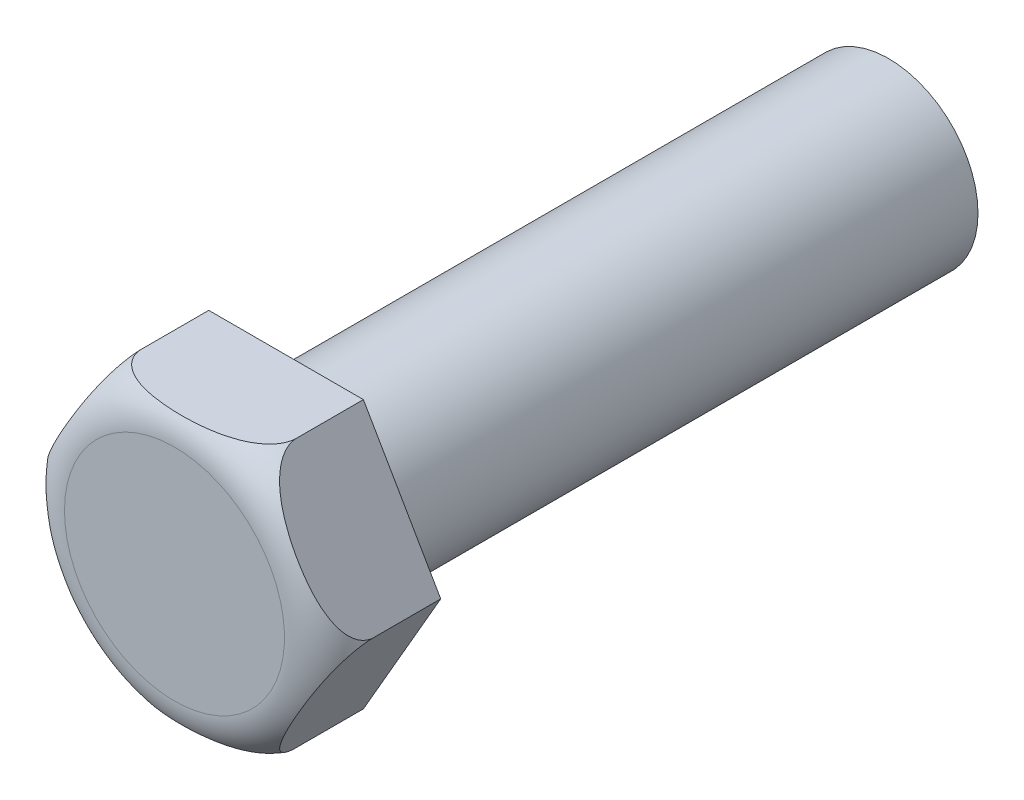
SolidWorks part; units mm, degrees
ref_plane "Front" through (0, 0, 0) normal (0, 0, 1) x (1, 0, 0)
ref_plane "Top" through (0, 0, 0) normal (0, 1, 0) x (1, 0, 0)
ref_plane "Right" through (0, 0, 0) normal (1, 0, 0) x (0, 0, -1)
sketch "Sketch1" plane through (0, 0, 0) normal (0, 0, 1) x (1, 0, 0)
  circle A1 centre (35, 0) radius 4
extrude "Extrude1" add sketch "Sketch1" against normal blind 27
sketch "Sketch2" plane through (0, 0, 0) normal (0, 0, 1) x (1, 0, 0)
  line L1 (41.9282, 0) -> (38.4641, 6)
  line L2 (38.4641, 6) -> (31.5359, 6)
  line L3 (31.5359, 6) -> (28.0718, 0)
  line L4 (28.0718, 0) -> (31.5359, -6)
  line L5 (31.5359, -6) -> (38.4641, -6)
  line L6 (38.4641, -6) -> (41.9282, 0)
  circle A0 centre (35, 0) radius 6 construction
  circle A1 centre (35, 0) radius 4 construction
  dimension "D1" = 12
extrude "Extrude2" add sketch "Sketch2" along normal blind 5
ref_plane "Plane1" through (0, 0, 0) normal (0, -1, 0) x (1, 0, 0)
sketch "Sketch3" plane through (0, 0, 0) normal (0, -1, 0) x (1, 0, 0)
  line L6 (38.4641, 5) -> (41.9282, 5) construction
  line L7 (41.9282, 5) -> (41.9282, 0) construction
  line L8 (35, -27) -> (35, 7.5486) construction
  line L9 (31, -27) -> (39, -27) construction
  line L10 (39.9282, 5) -> (39.9282, 6.2954)
  line L11 (39.9282, 6.2954) -> (43.3154, 6.2954)
  line L12 (43.3154, 6.2954) -> (43.3154, 3)
  line L13 (43.3154, 3) -> (41.9282, 3)
  arc A0 (39.9282, 5) -> (41.9282, 3) centre (39.9282, 3) cw
  dimension "D1" = 2
revolve "Cut-Revolve1" cut sketch "Sketch3" angle 360 about L8
